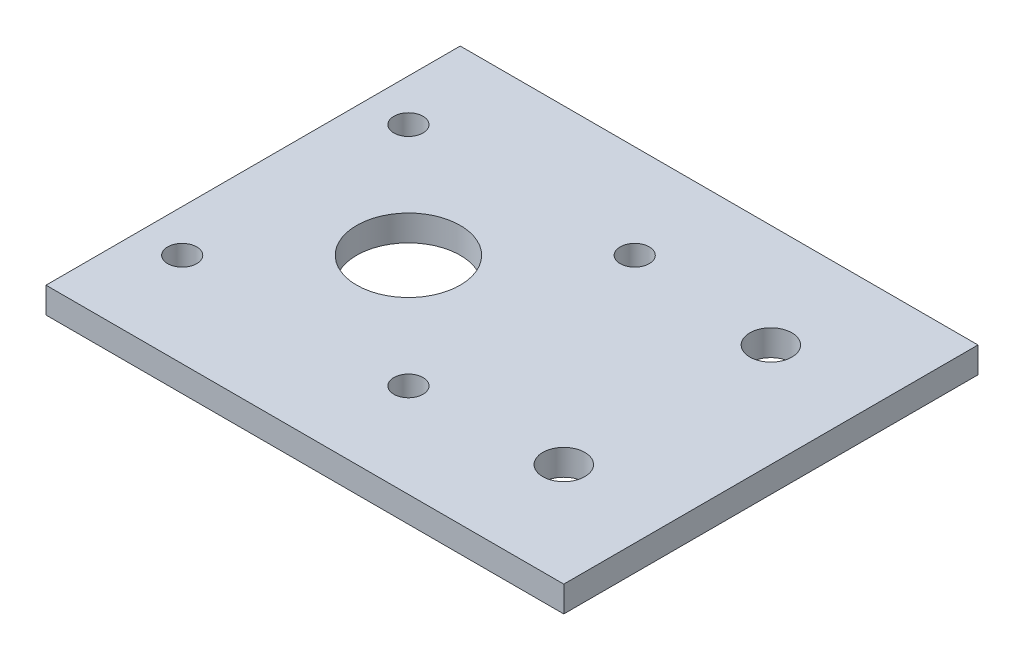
SolidWorks part; units mm, degrees
ref_plane "Front Plane" through (0, 0, 0) normal (0, 0, 1) x (1, 0, 0)
ref_plane "Top Plane" through (0, 0, 0) normal (0, 1, 0) x (1, 0, 0)
ref_plane "Right Plane" through (0, 0, 0) normal (1, 0, 0) x (0, 0, -1)
sketch "Sketch5" plane through (0, 0, 0) normal (0, 1, 0) x (1, 0, 0)
  line L1 (0, 0) -> (-254, 0)
  line L2 (0, 0) -> (0, -203.2)
  line L3 (0, -203.2) -> (-254, -203.2)
  line L4 (-254, 0) -> (-254, -203.2)
  dimension "D1" = 254
  dimension "D2" = 203.2
extrude "Extrude1" add sketch "Sketch5" along normal blind 12.7
sketch "Sketch6" plane through (0, 12.7, 0) normal (0, 1, 0) x (1, 0, 0)
  line L0 (0, -203.2) -> (0, 0) construction
  line L1 (0, 0) -> (-254, 0) construction
  circle A0 centre (-50.8, -50.8) radius 10.3188
  dimension "D1" = 20.6375
  dimension "D2" = 50.8
  dimension "D3" = 50.8
extrude "Cut-Extrude1" cut sketch "Sketch6" against normal blind 12.7
sketch "Sketch7" plane through (0, 12.7, 0) normal (0, 1, 0) x (1, 0, 0)
  line L0 (0, -203.2) -> (0, 0) construction
  line L1 (0, 0) -> (-254, 0) construction
  circle A0 centre (-50.8, -152.4) radius 10.3187
  circle A1 centre (-50.8, -50.8) radius 10.3188 construction
  dimension "D1" = 20.6375
  dimension "D2" = 50.8
  dimension "D3" = 152.4
extrude "Cut-Extrude3" cut sketch "Sketch7" against normal blind 12.7
sketch "Sketch8" plane through (0, 12.7, 0) normal (0, 1, 0) x (1, 0, 0)
  line L0 (0, -203.2) -> (0, 0) construction
  line L1 (0, 0) -> (-254, 0) construction
  circle A0 centre (-177.8, -101.6) radius 25.4
  dimension "D1" = 50.8
  dimension "D2" = 177.8
  dimension "D3" = 101.6
extrude "Cut-Extrude4" cut sketch "Sketch8" against normal blind 12.7
sketch "Sketch9" plane through (0, 12.7, 0) normal (0, 1, 0) x (1, 0, 0)
  line L0 (-122.301, -157.099) -> (-122.301, -46.101)
  line L1 (-122.301, -101.6) -> (-233.299, -101.6)
  line L2 (-177.8, -157.099) -> (-177.8, -46.101)
  line L3 (-122.301, -46.101) -> (-233.299, -46.101)
  line L4 (-233.299, -157.099) -> (-233.299, -46.101)
  line L5 (-122.301, -157.099) -> (-233.299, -157.099)
  point P9 (-177.8, -101.6)
  dimension "D1" = 55.499
  dimension "D2" = 55.499
sketch "Sketch10" plane through (0, 12.7, 0) normal (0, 1, 0) x (1, 0, 0)
  circle A0 centre (-122.301, -46.101) radius 7.1438
  dimension "D1" = 14.2875
extrude "Cut-Extrude5" cut sketch "Sketch10" against normal blind 12.7
sketch "Sketch11" plane through (0, 12.7, 0) normal (0, 1, 0) x (1, 0, 0)
  circle A0 centre (-122.301, -157.099) radius 7.1437
  dimension "D1" = 14.2875
extrude "Cut-Extrude6" cut sketch "Sketch11" against normal blind 12.7
ref_plane "Plane2" through (-177.8, 0, 0) normal (1, 0, 0) x (0, 0, -1)
mirror "Mirror1" about plane through (-177.8, 0, 0) normal (1, 0, 0) of "Cut-Extrude6", "Cut-Extrude5"
